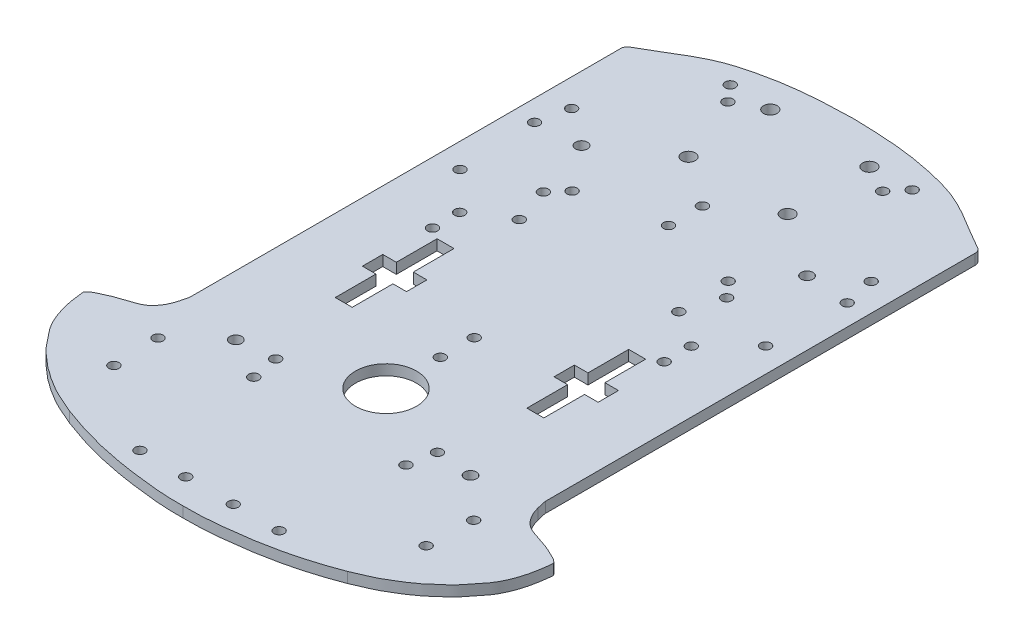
SolidWorks part; units mm, degrees
ref_plane "Front Plane" through (0, 0, 0) normal (0, 0, 1) x (1, 0, 0)
ref_plane "Top Plane" through (0, 0, 0) normal (0, 1, 0) x (1, 0, 0)
ref_plane "Right Plane" through (0, 0, 0) normal (1, 0, 0) x (0, 0, -1)
sketch "Sketch1" plane through (0, 0, 0) normal (0, 1, 0) x (1, 0, 0)
  line L0 (230.6353, 1206.0361) -> (1428.6353, 1206.0361) construction
  line L1 (6.5971, -67.3056) -> (6.5971, 155.4752) construction
  line L2 (-45.6299, 8.3562) -> (-45.6299, 129.1267)
  line L3 (58.8241, 8.3562) -> (58.8241, 129.1267)
  line L4 (-45.6299, 129.7278) -> (-45.6299, 129.1267)
  line L5 (-44.6067, 131.473) -> (-43.7759, 131.938)
  line L6 (58.8241, 129.7278) -> (58.8241, 129.1267)
  line L7 (57.801, 131.473) -> (56.9702, 131.938)
  line L8 (-45.6299, 8.3562) -> (-45.6299, 3.1385)
  line L9 (58.8241, 8.3562) -> (58.8241, 3.1385)
  circle A0 centre (6.5971, 8.3562) radius 9
  arc A1 (-45.6299, 129.7278) -> (-44.6067, 131.473) centre (-43.6299, 129.7278) cw
  arc A2 (58.8241, 129.7278) -> (57.801, 131.473) centre (56.8241, 129.7278) ccw
  spline S0 degree 3 poles (6.5971, 146.1329) (0.8751, 145.9767) (-7.5908, 145.7157) (-19.0522, 143.5713) (-30.756, 140.4625) (-38.4551, 134.8236) (-43.7759, 131.938) knots 0 0 0 0 0.323137 0.474438 0.657028 1 1 1 1
  spline S1 degree 3 poles (6.5971, 146.1329) (12.3192, 145.9767) (20.7851, 145.7157) (32.2464, 143.5713) (43.9503, 140.4625) (51.6494, 134.8236) (56.9702, 131.938) knots 0 0 0 0 0.323137 0.474438 0.657028 1 1 1 1
  spline S2 degree 3 poles (-62.6687, -11.5182) (-61.8553, -10.4544) (-59.9573, -9.7258) (-57.5429, -8.4996) (-55.5185, -7.8568) (-53.5832, -7.1173) (-51.7065, -6.6017) (-49.9753, -5.7292) (-47.7036, -3.6638) (-46.6616, -1.3637) (-46.2283, 0.3353) knots 0 0 0 0 0.182315 0.279995 0.382664 0.480933 0.572284 0.656662 0.751766 1 1 1 1
  spline S3 degree 3 poles (-46.2283, 0.3353) (-46.0499, 1.2751) (-45.6825, 2.1738) (-45.6299, 3.1385) knots 0 0 0 0 1 1 1 1
  spline S4 degree 3 poles (59.4225, 0.3353) (59.2442, 1.2751) (58.8768, 2.1738) (58.8241, 3.1385) knots 0 0 0 0 1 1 1 1
  spline S5 degree 3 poles (75.8629, -11.5182) (75.0496, -10.4544) (73.1516, -9.7258) (70.7372, -8.4996) (68.7128, -7.8568) (66.7775, -7.1173) (64.9008, -6.6017) (63.1696, -5.7292) (60.8979, -3.6638) (59.8559, -1.3637) (59.4225, 0.3353) knots 0 0 0 0 0.182315 0.279995 0.382664 0.480933 0.572284 0.656662 0.751766 1 1 1 1
  spline S6 degree 3 poles (-62.6687, -11.5182) (-62.5467, -12.8326) (-62.2663, -14.909) (-61.7385, -17.7492) (-61.0271, -20.1893) (-59.9777, -22.9421) (-58.2523, -26.1631) (-56.0551, -28.4218) (-54.3543, -30.8333) (-52.6079, -32.7581) (-50.3888, -34.3433) (-48.821, -36.0298) (-47.2237, -36.9293) (-45.7098, -38.2358) (-43.9921, -39.1372) (-42.3602, -40.2344) (-40.6246, -41.1795) (-37.918, -42.4196) (-35.7875, -43.3124) (-34.3997, -43.9222) knots 0 0 0 0 0.086921 0.137992 0.190119 0.254074 0.331995 0.428709 0.459954 0.526386 0.598566 0.639017 0.676812 0.718335 0.770195 0.803933 0.847851 0.900152 1 1 1 1
  spline S7 degree 3 poles (-34.3997, -43.9222) (-32.3566, -44.6275) (-29.1489, -45.8905) (-24.413, -47.2287) (-20.3647, -48.3332) (-16.2526, -49.1266) (-12.0684, -49.9616) (-7.6711, -50.4909) (-1.3803, -51.2966) (3.4099, -51.5133) (6.5971, -51.4602) knots 0 0 0 0 0.154778 0.246355 0.352136 0.455017 0.546021 0.657453 0.771874 1 1 1 1
  spline S8 degree 3 poles (75.8629, -11.5182) (75.741, -12.8326) (75.4606, -14.909) (74.9328, -17.7492) (74.2214, -20.1893) (73.172, -22.9421) (71.4465, -26.1631) (69.2494, -28.4218) (67.5485, -30.8333) (65.8022, -32.7581) (63.5831, -34.3433) (62.0152, -36.0298) (60.418, -36.9293) (58.9041, -38.2358) (57.1864, -39.1372) (55.5544, -40.2344) (53.8189, -41.1795) (51.1123, -42.4196) (48.9818, -43.3124) (47.594, -43.9222) knots 0 0 0 0 0.086921 0.137992 0.190119 0.254074 0.331995 0.428709 0.459954 0.526386 0.598566 0.639017 0.676812 0.718335 0.770195 0.803933 0.847851 0.900152 1 1 1 1
  spline S9 degree 3 poles (47.594, -43.9222) (45.5509, -44.6275) (42.3432, -45.8905) (37.6073, -47.2287) (33.559, -48.3332) (29.4469, -49.1266) (25.2627, -49.9616) (20.8653, -50.4909) (14.5745, -51.2966) (9.7844, -51.5133) (6.5971, -51.4602) knots 0 0 0 0 0.154778 0.246355 0.352136 0.455017 0.546021 0.657453 0.771874 1 1 1 1
  dimension "D1" = 18
  dimension "D3" = 120.7705
  dimension "D2" = 2
  dimension "D4" = 53.2818
  dimension "D5" = 0.6011
  dimension "D7" = 21.3009
  dimension "D8" = 45.5613
  dimension "D9" = 41.9136
  dimension "D6" = 5.2177
extrude "Boss-Extrude1" add sketch "Sketch1" along normal blind 3.1
sketch "Sketch2" plane through (0, 3.1, 0) normal (0, 1, 0) x (1, 0, 0)
  line L0 (6.5971, 8.3562) -> (6.5971, 146.1329) construction
  line L1 (6.5971, 8.3562) -> (6.5971, -51.4602) construction
  line L2 (32.3241, 42.1329) -> (28.3241, 42.1329)
  line L3 (37.3241, 36.1329) -> (41.3241, 36.1329)
  line L4 (32.3241, 36.1329) -> (32.3241, 24.1329)
  line L5 (37.3241, 36.1329) -> (37.3241, 24.1329)
  line L6 (41.3241, 36.1329) -> (41.3241, 42.1329)
  line L7 (28.3241, 36.1329) -> (32.3241, 36.1329)
  line L8 (28.3241, 42.1329) -> (28.3241, 36.1329)
  line L9 (41.3241, 42.1329) -> (37.3241, 42.1329)
  line L10 (32.3241, 24.1329) -> (37.3241, 24.1329)
  line L11 (32.3241, 54.1329) -> (32.3241, 42.1329)
  line L12 (37.3241, 54.1329) -> (32.3241, 54.1329)
  line L13 (37.3241, 54.1329) -> (37.3241, 42.1329)
  line L14 (-24.1299, 54.1329) -> (-24.1299, 42.1329)
  line L15 (-24.1299, 54.1329) -> (-19.1299, 54.1329)
  line L16 (-19.1299, 54.1329) -> (-19.1299, 42.1329)
  line L17 (-19.1299, 24.1329) -> (-24.1299, 24.1329)
  line L18 (-28.1299, 42.1329) -> (-24.1299, 42.1329)
  line L19 (-15.1299, 42.1329) -> (-15.1299, 36.1329)
  line L20 (-15.1299, 36.1329) -> (-19.1299, 36.1329)
  line L21 (-28.1299, 36.1329) -> (-28.1299, 42.1329)
  line L22 (-24.1299, 36.1329) -> (-24.1299, 24.1329)
  line L23 (-19.1299, 36.1329) -> (-19.1299, 24.1329)
  line L24 (-24.1299, 36.1329) -> (-28.1299, 36.1329)
  line L25 (-19.1299, 42.1329) -> (-15.1299, 42.1329)
  line L26 (58.8241, 3.1385) -> (58.8241, 129.7278) construction
  dimension "D1" = 5
  dimension "D2" = 6
  dimension "D3" = 12
  dimension "D5" = 12
  dimension "D6" = 17.5
  dimension "D7" = 92
extrude "Cut-Extrude1" cut sketch "Sketch2" against normal through all
sketch "Sketch3" plane through (0, 3.1, 0) normal (0, 1, 0) x (1, 0, 0)
  line L0 (6.5971, 8.3562) -> (6.5971, 153.7856) construction
  line L1 (6.5971, 8.3562) -> (6.5971, -61.4419) construction
  line L2 (6.5971, 146.1861) -> (6.5971, -91.4493) construction
  line L3 (-8.0029, 112.0861) -> (21.1971, 112.0861) construction
  line L4 (-45.6299, 129.7278) -> (-45.6299, 3.1385) construction
  line L5 (6.5971, 146.1861) -> (-43.0286, 146.1861) construction
  circle A0 centre (-8.0029, 136.1861) radius 2
  circle A1 centre (-20.2029, 136.5861) radius 1.5
  circle A2 centre (-16.2029, 131.8861) radius 1.5
  circle A3 centre (-8.0029, 112.0861) radius 2
  circle A4 centre (-37.5299, 107.1861) radius 1.5
  circle A5 centre (-39.4599, 98.1861) radius 1.5
  circle A6 centre (-26.6299, 99.1861) radius 1.75
  circle A7 centre (6.5971, 101.5861) radius 1.5
  circle A8 centre (6.5971, 91.5861) radius 1.5
  circle A9 centre (21.1971, 136.1861) radius 2
  circle A10 centre (33.3971, 136.5861) radius 1.5
  circle A11 centre (29.3971, 131.8861) radius 1.5
  circle A12 centre (21.1971, 112.0861) radius 2
  circle A13 centre (39.8241, 99.1861) radius 1.75
  circle A14 centre (52.6541, 98.1861) radius 1.5
  circle A15 centre (50.7241, 107.1861) radius 1.5
  circle A16 centre (-16.4029, 86.1861) radius 1.5
  circle A17 centre (-20.4029, 81.7139) radius 1.5
  circle A18 centre (-38.4299, 75.1861) radius 1.5
  circle A19 centre (-27.5299, 56.1861) radius 1.5
  circle A20 centre (-27.5299, 64.1861) radius 1.5
  circle A21 centre (-16.9029, 71.1329) radius 1.5
  circle A22 centre (30.0971, 71.1329) radius 1.5
  circle A23 centre (29.5971, 86.1861) radius 1.5
  circle A24 centre (33.5971, 81.7139) radius 1.5
  circle A25 centre (51.6241, 75.1861) radius 1.5
  circle A26 centre (40.7241, 64.1861) radius 1.5
  circle A27 centre (40.7241, 56.1861) radius 1.5
  circle A28 centre (-27.9799, -1.3139) radius 1.75
  circle A29 centre (-17.2299, -0.3139) radius 1.5
  circle A30 centre (-15.8177, -8.1883) radius 1.5
  circle A31 centre (-39.9029, -12.3139) radius 1.5
  circle A32 centre (-39.4029, -25.8139) radius 1.5
  circle A33 centre (6.5971, 24.3562) radius 1.5
  circle A34 centre (6.5971, 34.3562) radius 1.5
  circle A35 centre (-13.9029, -43.6438) radius 1.5
  circle A36 centre (-0.4029, -43.6438) radius 1.5
  circle A37 centre (13.5971, -43.6438) radius 1.5
  circle A38 centre (27.0971, -43.6438) radius 1.5
  circle A39 centre (52.5971, -25.8139) radius 1.5
  circle A40 centre (53.0971, -12.3139) radius 1.5
  circle A41 centre (29.012, -8.1883) radius 1.5
  circle A42 centre (41.1741, -1.3139) radius 1.75
  circle A43 centre (30.4241, -0.3139) radius 1.5
  dimension "D1" = 4
  dimension "D2" = 3
  dimension "D3" = 3
  dimension "D4" = 4
  dimension "D6" = 3
  dimension "D8" = 3
  dimension "D9" = 3.5
  dimension "D11" = 3
  dimension "D13" = 3
  dimension "D21" = 3
  dimension "D23" = 3
  dimension "D24" = 3
  dimension "D26" = 3
  dimension "D30" = 3
  dimension "D31" = 3
  dimension "D32" = 3.5
  dimension "D33" = 3
  dimension "D34" = 3
  dimension "D39" = 3
  dimension "D40" = 3
  dimension "D36" = 3
  dimension "D50" = 3
  dimension "D51" = 3
  dimension "D61" = 3
  dimension "D5" = 9.6
  dimension "D7" = 48
  dimension "D10" = 10.5
  dimension "D12" = 10
  dimension "D14" = 26.8
  dimension "D15" = 14.3
  dimension "D16" = 22.8
  dimension "D17" = 39
  dimension "D18" = 6.17
  dimension "D19" = 10
  dimension "D20" = 14.6
  dimension "D22" = 6
  dimension "D25" = 8
  dimension "D27" = 8.1
  dimension "D28" = 47
  dimension "D29" = 19
  dimension "D35" = 34.1
  dimension "D37" = 60
  dimension "D38" = 13.5
  dimension "D41" = 13.5
  dimension "D42" = 10
  dimension "D43" = 7.2
  dimension "D44" = 52
  dimension "D45" = 7
  dimension "D46" = 71
  dimension "D47" = 82
  dimension "D48" = 18.1
  dimension "D49" = 16
  dimension "D52" = 146.5
  dimension "D53" = 28.4
  dimension "D54" = 17.65
  dimension "D55" = 147.5
  dimension "D56" = 46.5
  dimension "D57" = 172
  dimension "D58" = 8
  dimension "D59" = 23
  dimension "D60" = 46
extrude "Cut-Extrude2" cut sketch "Sketch3" against normal through all
